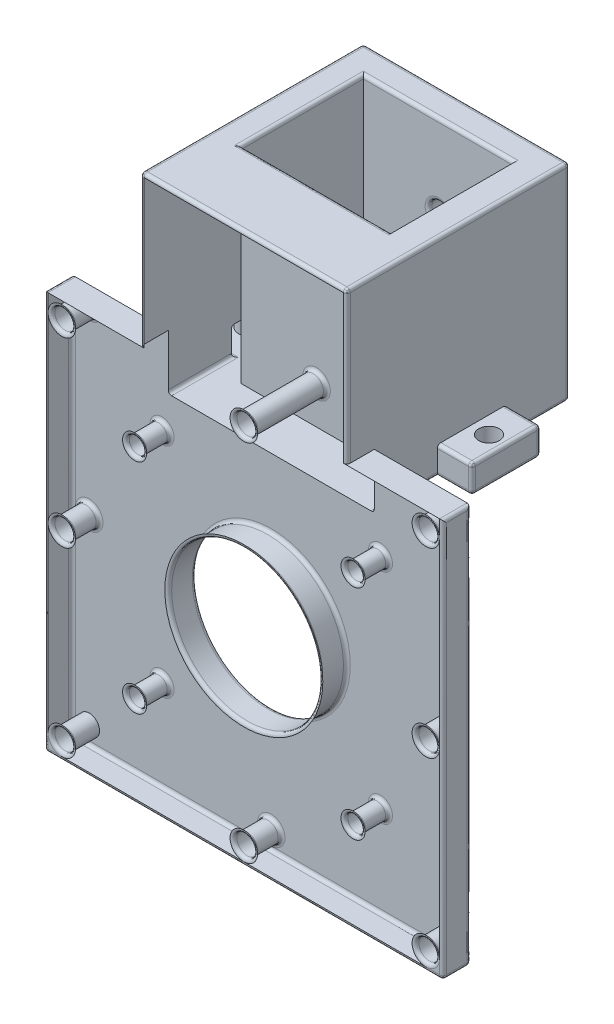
SolidWorks part; units mm, degrees
ref_plane "Front Plane" through (0, 0, 0) normal (0, 0, 1) x (1, 0, 0)
ref_plane "Top Plane" through (0, 0, 0) normal (0, 1, 0) x (1, 0, 0)
ref_plane "Right Plane" through (0, 0, 0) normal (1, 0, 0) x (0, 0, -1)
sketch "Sketch1" plane through (0, 0, 0) normal (0, 1, 0) x (1, 0, 0)
  line L0 (-15, 12.9) -> (-15, -8.9)
  line L1 (-11, 8.9) -> (11, 8.9)
  line L2 (-11, 8.9) -> (-11, -8.9)
  line L3 (-11, -8.9) -> (11, -8.9)
  line L4 (11, 8.9) -> (11, -8.9)
  line L5 (-11, 8.9) -> (11, -8.9) construction
  line L6 (-11, -8.9) -> (11, 8.9) construction
  line L8 (15, 12.9) -> (15, -8.9)
  line L9 (-15, 12.9) -> (15, 12.9)
  line L12 (-15, 12.9) -> (-15, -12.9) construction
  line L13 (-15, -12.9) -> (15, -12.9) construction
  line L14 (15, 12.9) -> (15, -12.9) construction
  line L16 (-11, -8.9) -> (11, -8.9)
  line L17 (-15, -8.9) -> (-15, -19.5)
  line L18 (-15, -19.5) -> (15, -19.5)
  line L19 (15, -8.9) -> (15, -19.5)
  point P0 (0, 0)
  dimension "D1" = 22
  dimension "D2" = 17.8
  dimension "D4" = 10.6
  dimension "D3" = 4
extrude "Boss-Extrude1" add sketch "Sketch1" along normal blind 30 contours L19 L8 L9 L0 L17 L18 L1 L4 L3 L2
sketch "Sketch2" plane through (0, 0, -12.9) normal (0, 0, -1) x (-1, 0, 0)
  line L0 (0, 30) -> (0, 0) construction
  line L1 (15, 30) -> (-15, 30) construction
  circle A0 centre (0, 18) radius 1.5
  dimension "D2" = 3
  dimension "D1" = 12
extrude "Cut-Extrude1" cut sketch "Sketch2" against normal blind 13.08
sketch "Sketch3" plane through (0, 0, 0) normal (0, -1, 0) x (1, 0, 0)
  line L0 (15, 19.5) -> (-33.678, 19.5) construction
  line L1 (-33.678, 19.5) -> (25.8575, 19.5) construction
  line L2 (0, -12.9) -> (0, 19.5) construction
  line L3 (21, 19.5) -> (-21, 19.5)
  line L4 (21, 19.5) -> (21, 15.5)
  line L5 (21, 15.5) -> (-21, 15.5)
  line L6 (-21, 19.5) -> (-21, 15.5)
  line L7 (-15, -12.9) -> (15, -12.9) construction
  dimension "D1" = 4
  dimension "D2" = 42
  dimension "D3" = 21
extrude "Boss-Extrude2" add sketch "Sketch3" along normal blind 42
sketch "Sketch4" plane through (0, 0, 15.5) normal (0, 0, -1) x (-1, 0, 0)
  line L0 (0, -42) -> (0, 0) construction
  line L1 (21, -42) -> (-21, -42) construction
  line L2 (15, 0) -> (-15, 0) construction
  line L3 (-21, -21) -> (21, -21) construction
  line L4 (-21, -42) -> (-21, 0) construction
  line L5 (21, -42) -> (21, 0) construction
  line L6 (-15.9, 0) -> (-15.9, -42) construction
  line L7 (-15, 0) -> (-21, 0) construction
  circle A0 centre (0, -21) radius 11
  circle A1 centre (-15.9, -5.1) radius 1.25
  circle A2 centre (-15.9, -36.9) radius 1.25
  circle A3 centre (15.9, -36.9) radius 1.25
  circle A4 centre (15.9, -5.1) radius 1.25
  dimension "D1" = 22
  dimension "D4" = 2.5
  dimension "D2" = 5.1
  dimension "D3" = 5.1
extrude "Cut-Extrude2" cut sketch "Sketch4" against normal blind 42
sketch "Sketch6" plane through (0, 0, 19.5) normal (0, 0, 1) x (1, 0, 0)
  line L0 (-15, 0) -> (-21, 0) construction
  line L1 (-24, 3) -> (-15, 3)
  line L2 (-24, 3) -> (-24, -45)
  line L3 (-24, -45) -> (24, -45)
  line L4 (24, 3) -> (24, -45)
  line L5 (-21, -42) -> (-21, 0) construction
  line L6 (21, -42) -> (21, 0) construction
  line L7 (21, -42) -> (-21, -42) construction
  line L8 (-15, 3) -> (-15, 0)
  line L9 (-15, 30) -> (-15, 0) construction
  line L10 (-15, 0) -> (-21, 0)
  line L11 (-21, 0) -> (-21, -42)
  line L12 (-21, -42) -> (21, -42)
  line L13 (21, -42) -> (21, 0)
  line L14 (21, 0) -> (15, 0)
  line L15 (15, 0) -> (15, 3)
  line L16 (15, 30) -> (15, 0) construction
  line L17 (15, 3) -> (24, 3)
  dimension "D1" = 3
  dimension "D2" = 3
  dimension "D3" = 3
  dimension "D4" = 3
extrude "Boss-Extrude5" add sketch "Sketch6" against normal blind 4
sketch "Sketch8" plane through (0, 0, 19.5) normal (0, 0, 1) x (1, 0, 0)
  line L0 (-15, 3) -> (-24, 3) construction
  line L1 (-29, 8) -> (-15, 8)
  line L2 (-29, 8) -> (-29, -50)
  line L3 (-29, -50) -> (29, -50)
  line L4 (29, 8) -> (29, -50)
  line L5 (-24, 3) -> (-24, -45) construction
  line L6 (-24, -45) -> (24, -45) construction
  line L7 (24, -45) -> (24, 3) construction
  line L8 (-15, 8) -> (-15, 3)
  line L9 (-15, 30) -> (-15, 3) construction
  line L10 (-15, 3) -> (-24, 3)
  line L11 (-24, 3) -> (-24, -45)
  line L12 (-24, -45) -> (24, -45)
  line L13 (24, -45) -> (24, 3)
  line L14 (24, 3) -> (15, 3)
  line L15 (15, 3) -> (15, 8)
  line L16 (15, 8) -> (29, 8)
  dimension "D1" = 5
  dimension "D2" = 5
  dimension "D3" = 5
  dimension "D4" = 5
extrude "Boss-Extrude7" add sketch "Sketch8" against normal blind 4
sketch "Sketch10" plane through (0, 0, 19.5) normal (0, 0, 1) x (1, 0, 0)
  line L0 (-26.5, 8) -> (-26.5, -50) construction
  line L1 (-15, 8) -> (-29, 8) construction
  line L2 (-29, -50) -> (29, -50) construction
  line L3 (0, -50) -> (0, 30) construction
  line L4 (-15, 30) -> (15, 30) construction
  line L5 (-29, 8) -> (-29, -50) construction
  line L6 (29, -21) -> (-29, -21) construction
  line L7 (29, -50) -> (29, 8) construction
  line L8 (26.5, 8) -> (26.5, -50) construction
  line L9 (-26.5, -47.5) -> (26.5, -47.5) construction
  line L10 (-26.5, 5.5) -> (26.5, 5.5) construction
  circle A0 centre (-26.5, 5.5) radius 1.5
  circle A1 centre (-26.5, -21) radius 1.5
  circle A2 centre (-26.5, -47.5) radius 1.5
  circle A3 centre (26.5, -47.5) radius 1.5
  circle A4 centre (26.5, -21) radius 1.5
  circle A5 centre (26.5, 5.5) radius 1.5
  circle A6 centre (0, -47.5) radius 1.5
  circle A7 centre (0, 5.5) radius 1.5
  dimension "D2" = 3
  dimension "D3" = 3
  dimension "D5" = 3
  dimension "D6" = 3
  dimension "D1" = 2.5
  dimension "D4" = 2.5
extrude "Cut-Extrude3" cut sketch "Sketch10" against normal blind 20.07
fillet "Fillet1" radius 0.5 27 edges at (-1.5, 18, -8.9) (-1.5, 18, -12.9) (-1.5, 5.5, 8.9) (-11, -21, 15.5) (1.5, 5.5, 19.5) (-25, 5.5, 19.5) (-17.15, -5.1, 19.5) (-25, -21, 19.5) (-11, -21, 19.5) (-17.15, -36.9, 19.5) (-28, -47.5, 19.5) (1.5, -47.5, 19.5) (14.65, -36.9, 19.5) (14.65, -5.1, 19.5) (25, 5.5, 19.5) (25, -21, 19.5) (28, -47.5, 19.5) (1.5, -47.5, 15.5) (-17.15, -36.9, 15.5) (-25, -21, 15.5) (-25, 5.5, 15.5) (-14.65, -5.1, 15.5) (28, 5.5, 15.5) (14.65, -5.1, 15.5) (17.15, -36.9, 15.5) (28, -47.5, 15.5) (28, -21, 15.5)
sketch "Sketch11" plane through (0, 0, 0) normal (0, -1, 0) x (1, 0, 0)
  line L0 (15, 1.3) -> (-15, 1.3) construction
  line L1 (15, -12.9) -> (15, 15.5) construction
  line L2 (-15, -12.9) -> (-15, 15.5) construction
  line L3 (0, -12.9) -> (0, 22.6593) construction
  line L4 (15, -3.7) -> (20, -3.7)
  line L5 (15, -3.7) -> (15, 6.3)
  line L6 (15, 6.3) -> (20, 6.3)
  line L7 (20, -3.7) -> (20, 6.3)
  line L8 (-15, -12.9) -> (15, -12.9) construction
  line L9 (-20, -3.7) -> (-20, 6.3)
  line L10 (-15, 6.3) -> (-20, 6.3)
  line L11 (-15, -3.7) -> (-15, 6.3)
  line L12 (-15, -3.7) -> (-20, -3.7)
  point P10 (17.5, -3.7)
  dimension "D1" = 10
  dimension "D2" = 5
  dimension "D3" = 5
extrude "Boss-Extrude8" add sketch "Sketch11" against normal blind 4
sketch "Sketch12" plane through (0, 0, 0) normal (0, -1, 0) x (1, 0, 0)
  line L0 (20, 1.3) -> (-20, 1.3) construction
  line L1 (20, -3.7) -> (20, 6.3) construction
  line L2 (-20, 6.3) -> (-20, -3.7) construction
  line L3 (17.5, -3.7) -> (17.5, 6.3) construction
  line L4 (15, -3.7) -> (20, -3.7) construction
  line L5 (20, 6.3) -> (15, 6.3) construction
  line L6 (0, -12.9) -> (0, 21.9007) construction
  line L7 (-15, -12.9) -> (15, -12.9) construction
  circle A0 centre (17.5, 1.3) radius 1.5
  circle A1 centre (-17.5, 1.3) radius 1.5
  dimension "D1" = 3
extrude "Cut-Extrude4" cut sketch "Sketch12" against normal blind 10.76
fillet "Fillet2" radius 0.5 32 edges at (0, 0, -12.9) (-15, 0, -8.3) (-15, 0, 10.9) (15, 0, -8.3) (15, 0, 10.9) (15, 19, 19.5) (15, 30, 3.3) (-15, 19, 19.5) (-15, 30, 3.3) (0, 30, 19.5) (15, 15, -12.9) (-15, 15, -12.9) (0, 30, -12.9) (0, 30, 8.9) (-11, 30, 0) (0, 30, -8.9) (-17.5, 0, 6.3) (-17.5, 4, 6.3) (-17.5, 4, -3.7) (-20, 2, 6.3) (-20, 2, -3.7) (-20, 4, 1.3) (-17.5, 0, -3.7) (-20, 0, 1.3) (17.5, 4, 6.3) (17.5, 0, 6.3) (20, 2, 6.3) (20, 0, 1.3) (20, 4, 1.3) (17.5, 0, -3.7) (17.5, 4, -3.7) (20, 2, -3.7)
fillet "Fillet3" radius 0.5 10 edges at (29, -50, 17.5) (0, -50, 19.5) (0, -50, 15.5) (-29, -50, 17.5) (-29, -21, 19.5) (-29, -21, 15.5) (-29, 8, 17.5) (29, 8, 17.5) (29, -21, 19.5) (29, -21, 15.5)
